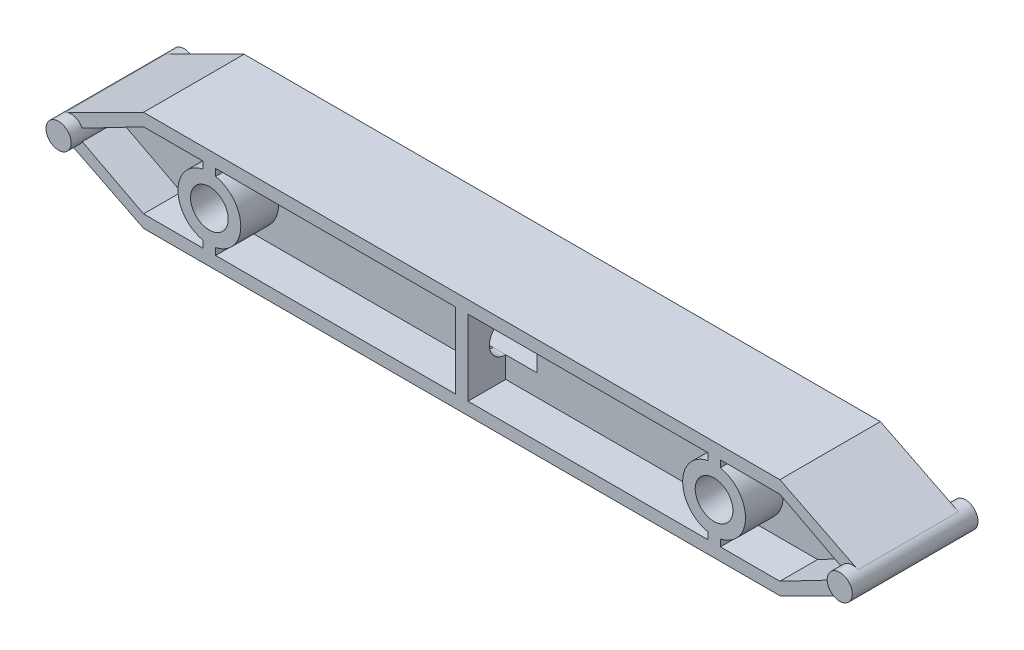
SolidWorks part; units mm, degrees
ref_plane "Front Plane" through (0, 0, 0) normal (0, 0, 1) x (1, 0, 0)
ref_plane "Top Plane" through (0, 0, 0) normal (0, 1, 0) x (1, 0, 0)
ref_plane "Right Plane" through (0, 0, 0) normal (1, 0, 0) x (0, 0, -1)
sketch "Sketch1" plane through (0, 0, 0) normal (0, 0, 1) x (1, 0, 0)
  line L0 (-74.6332, 0) -> (9.9828, 0)
  line L1 (-64.4732, -5.08) -> (-64.4732, 5.08)
  line L2 (-74.6332, 0) -> (-64.4732, 5.08)
  line L3 (-74.6332, 0) -> (-64.4732, -5.08)
  line L4 (-0.1772, -5.08) -> (-0.1772, 5.08)
  line L5 (-0.1772, 5.08) -> (9.9828, 0)
  line L6 (-0.1772, -5.08) -> (9.9828, 0)
  line L7 (-64.4732, 5.08) -> (-0.1772, 5.08)
  line L8 (-64.4732, -5.08) -> (-0.1772, -5.08)
  point P6 (-64.4732, 0)
  point P9 (-0.1772, 0)
  dimension "D1" = 84.6159
  dimension "D2" = 90
  dimension "D3" = 10.16
  dimension "D4" = 10.16
  dimension "D5" = 90
  dimension "D6" = 10.16
  dimension "D7" = 10.16
extrude "Boss-Extrude3" add sketch "Sketch1" along normal blind 10.16 contours L2 L0 L1 | L0 L3 L1 | L7 L1 L0 L4 | L1 L8 L4 L0 | L4 L6 L0 | L5 L4 L0
sketch "Sketch4" plane through (0, 0, 10.16) normal (0, 0, 1) x (1, 0, 0)
  line L0 (-74.6332, 0) -> (-64.4732, -5.08) construction
  line L1 (-74.6332, 0) -> (-64.4732, 5.08) construction
  line L2 (-0.1772, -5.08) -> (9.9828, 0) construction
  line L3 (-0.1772, 5.08) -> (9.9828, 0) construction
  line L4 (-0.1772, 5.08) -> (-0.1772, 3.81)
  line L5 (-0.1772, -5.08) -> (-0.1772, -3.81)
  line L6 (-0.1772, 3.81) -> (6.0164, 0.5863)
  line L7 (-0.1772, -3.81) -> (6.0164, -0.5863)
  line L8 (-64.4732, 5.08) -> (-64.4732, 3.81)
  line L9 (-64.4732, -5.08) -> (-64.4732, -3.81)
  line L10 (-64.4732, 3.81) -> (-70.6668, 0.5863)
  line L11 (-64.4732, -3.81) -> (-70.6668, -0.5863)
  line L12 (-64.4732, -3.81) -> (-0.1772, -3.81)
  line L13 (-0.1772, 3.81) -> (-64.4732, 3.81)
  circle A0 centre (-71.7934, 0) radius 1.27
  circle A1 centre (7.1429, 0) radius 1.27
  dimension "D1" = 2.54
  dimension "D2" = 2.54
  dimension "D3" = 1.27
  dimension "D4" = 1.27
  dimension "D5" = 1.27
  dimension "D6" = 1.27
extrude "Cut-Extrude1" cut sketch "Sketch4" against normal blind 3.81 contours A1 L6 L13 L10 A0 L11 L12 L7
sketch "Sketch6" plane through (0, 0, 10.16) normal (0, 0, 1) x (1, 0, 0)
  line L0 (-0.1772, -5.08) -> (9.9828, 0) construction
  line L1 (-0.1772, 5.08) -> (9.9828, 0) construction
  line L2 (-74.6332, 0) -> (-64.4732, -5.08) construction
  line L3 (-74.6332, 0) -> (-64.4732, 5.08) construction
  circle A0 centre (-71.7934, 0) radius 1.27
  circle A1 centre (7.1429, 0) radius 1.27
  dimension "D1" = 2.54
  dimension "D2" = 2.54
extrude "Boss-Extrude4" add sketch "Sketch6" along normal blind 1.27
sketch "Sketch7" plane through (0, 0, 10.16) normal (0, 0, 1) x (1, 0, 0)
  line L0 (9.9828, 0) -> (7.7109, 1.1359) construction
  line L1 (7.7109, -1.1359) -> (9.9828, 0) construction
  line L2 (-72.3613, 1.1359) -> (-74.6332, 0) construction
  line L3 (-74.6332, 0) -> (-72.3613, -1.1359) construction
  line L4 (9.9828, 0) -> (7.7109, 1.1359)
  line L5 (7.7109, -1.1359) -> (9.9828, 0)
  line L6 (-72.3613, 1.1359) -> (-74.6332, 0)
  line L7 (-74.6332, 0) -> (-72.3613, -1.1359)
  arc A0 (7.7109, -1.1359) -> (7.7109, 1.1359) centre (7.1429, 0) ccw construction
  arc A1 (-72.3613, 1.1359) -> (-72.3613, -1.1359) centre (-71.7934, 0) ccw construction
  arc A2 (7.7109, -1.1359) -> (7.7109, 1.1359) centre (7.1429, 0) ccw
  arc A3 (-72.3613, 1.1359) -> (-72.3613, -1.1359) centre (-71.7934, 0) ccw
extrude "Cut-Extrude2" cut sketch "Sketch7" against normal through all
sketch "Sketch9" plane through (0, 0, 0) normal (0, 0, -1) x (-1, 0, 0)
  circle A0 centre (-7.1429, 0) radius 1.27
  circle A1 centre (71.7934, 0) radius 1.27
  arc A2 (72.3613, -1.1359) -> (72.3613, 1.1359) centre (71.7934, 0) ccw construction
  arc A3 (-7.7109, 1.1359) -> (-7.7109, -1.1359) centre (-7.1429, 0) ccw construction
  dimension "D1" = 2.54
  dimension "D2" = 2.54
extrude "Boss-Extrude5" add sketch "Sketch9" along normal blind 1.27
sketch "Sketch10" plane through (0, 0, 0) normal (0, 0, -1) x (-1, 0, 0)
  line L0 (0.1772, 5.08) -> (0.1772, 3.81)
  line L1 (0.1772, -5.08) -> (0.1772, -3.81)
  line L2 (0.1772, 3.81) -> (-8.4129, 0)
  line L3 (0.1772, -3.81) -> (-8.4129, 0)
  line L4 (64.4732, 5.08) -> (64.4732, 3.81)
  line L5 (64.4732, -5.08) -> (64.4732, -3.81)
  line L6 (64.4732, -3.81) -> (70.6668, -0.5863)
  line L7 (64.4732, 3.81) -> (70.6668, 0.5863)
  line L8 (64.4732, -3.81) -> (0.1772, -3.81)
  line L9 (0.1772, 3.81) -> (64.4732, 3.81)
  arc A0 (-7.7109, -1.1359) -> (-7.7109, 1.1359) centre (-7.1429, 0) ccw construction
  arc A1 (72.3613, 1.1359) -> (72.3613, -1.1359) centre (71.7934, 0) ccw construction
  circle A2 centre (71.7934, 0) radius 1.27 construction
  dimension "D1" = 1.27
  dimension "D2" = 1.27
  dimension "D3" = 1.27
  dimension "D4" = 1.27
extrude "Cut-Extrude3" cut sketch "Sketch10" against normal blind 3.81 contours L9 L2 L3 L8 L6 L7 M9 M5
sketch "Sketch11" plane through (0, 0, 6.35) normal (0, 0, 1) x (1, 0, 0)
  line L0 (-73.0634, 0) -> (-57.8234, 0)
  line L1 (-57.8234, 0) -> (-40.0434, 0)
  line L2 (8.4129, 0) -> (-6.8271, 0)
  line L3 (-6.8271, 0) -> (-24.6071, 0)
  line L4 (-38.0114, 0) -> (-26.6391, 0)
  line L5 (-36.1352, 1.651) -> (-36.1352, -1.651)
  line L6 (-36.1352, 1.651) -> (-28.5152, 1.651)
  line L7 (-36.1352, -1.651) -> (-28.5152, -1.651)
  line L8 (-28.5152, 1.651) -> (-28.5152, -1.651)
  line L9 (-36.1352, 1.651) -> (-28.5152, -1.651) construction
  line L10 (-36.1352, -1.651) -> (-28.5152, 1.651) construction
  circle A0 centre (-71.7934, 0) radius 1.27 construction
  circle A1 centre (-57.8234, 0) radius 1.905
  circle A2 centre (-40.0434, 0) radius 2.032
  circle A3 centre (7.1429, 0) radius 1.27 construction
  circle A4 centre (-6.8271, 0) radius 1.905
  circle A5 centre (-24.6071, 0) radius 2.032
  point P19 (-32.3252, 0)
  point P21 (-32.3252, 0)
  dimension "D2" = 3.81
  dimension "D4" = 4.064
  dimension "D7" = 3.81
  dimension "D8" = 4.064
  dimension "D1" = 15.24
  dimension "D3" = 17.78
  dimension "D5" = 15.24
  dimension "D6" = 17.78
  dimension "D9" = 7.62
  dimension "D10" = 3.302
extrude "Cut-Extrude5" cut sketch "Sketch11" against normal through all contours L0 A1 L1 | L1 A1 L0 | L8 L6 L5 L4 | L8 L4 L5 L7 | L2 A4 L3
sketch "Sketch12" plane through (0, 0, 6.35) normal (0, 0, 1) x (1, 0, 0)
  line L0 (-58.4584, 3.81) -> (-58.4584, -3.81)
  line L1 (-58.4584, 3.81) -> (-57.1884, 3.81)
  line L2 (-58.4584, -3.81) -> (-57.1884, -3.81)
  line L3 (-57.1884, 3.81) -> (-57.1884, -3.81)
  line L4 (-58.4584, 3.81) -> (-57.1884, -3.81) construction
  line L5 (-58.4584, -3.81) -> (-57.1884, 3.81) construction
  line L6 (-71.7934, 0) -> (7.1429, 0) construction
  line L9 (-32.9602, 3.81) -> (-32.9602, -3.81)
  line L10 (-32.9602, 3.81) -> (-31.6902, 3.81)
  line L11 (-32.9602, -3.81) -> (-31.6902, -3.81)
  line L12 (-31.6902, 3.81) -> (-31.6902, -3.81)
  line L13 (-32.9602, 3.81) -> (-31.6902, -3.81) construction
  line L14 (-32.9602, -3.81) -> (-31.6902, 3.81) construction
  line L15 (-7.4621, 3.81) -> (-7.4621, -3.81)
  line L16 (-7.4621, 3.81) -> (-6.1921, 3.81)
  line L17 (-7.4621, -3.81) -> (-6.1921, -3.81)
  line L18 (-6.1921, 3.81) -> (-6.1921, -3.81)
  line L19 (-7.4621, 3.81) -> (-6.1921, -3.81) construction
  line L20 (-7.4621, -3.81) -> (-6.1921, 3.81) construction
  circle A0 centre (-57.8234, 0) radius 3.175
  circle A1 centre (-57.8234, 0) radius 1.905 construction
  circle A2 centre (-6.8271, 0) radius 3.175
  circle A3 centre (-6.8271, 0) radius 1.905 construction
  point P12 (-32.3252, 0)
  point P16 (-32.3252, 0)
  dimension "D1" = 1.27
  dimension "D4" = 1.27
  dimension "D2" = 1.27
  dimension "D3" = 1.27
  dimension "D5" = 1.27
extrude "Boss-Extrude6" add sketch "Sketch12" along normal blind 3.81
sketch "Sketch13" plane through (-32.9602, 0, 0) normal (-1, 0, 0) x (0, 0, 1)
  line L0 (6.35, 1.651) -> (6.35, -1.651) construction
  circle A0 centre (6.35, 0) radius 1.651
extrude "Cut-Extrude6" cut sketch "Sketch13" against normal blind 3.81
sketch "Sketch14" plane through (0, 0, 3.81) normal (0, 0, -1) x (-1, 0, 0)
  line L0 (6.1921, 3.81) -> (6.1921, -3.81)
  line L1 (6.1921, 3.81) -> (7.4621, 3.81)
  line L2 (6.1921, -3.81) -> (7.4621, -3.81)
  line L3 (7.4621, 3.81) -> (7.4621, -3.81)
  line L4 (6.1921, 3.81) -> (7.4621, -3.81) construction
  line L5 (6.1921, -3.81) -> (7.4621, 3.81) construction
  line L6 (57.1884, 3.81) -> (57.1884, -3.81)
  line L7 (57.1884, 3.81) -> (58.4584, 3.81)
  line L8 (57.1884, -3.81) -> (58.4584, -3.81)
  line L9 (58.4584, 3.81) -> (58.4584, -3.81)
  line L10 (57.1884, 3.81) -> (58.4584, -3.81) construction
  line L11 (57.1884, -3.81) -> (58.4584, 3.81) construction
  circle A0 centre (6.8271, 0) radius 3.175
  circle A1 centre (6.8271, 0) radius 1.905 construction
  circle A2 centre (57.8234, 0) radius 3.175
  circle A3 centre (57.8234, 0) radius 1.905 construction
  dimension "D1" = 1.27
  dimension "D3" = 1.27
  dimension "D2" = 1.27
  dimension "D4" = 1.27
extrude "Boss-Extrude7" add sketch "Sketch14" along normal blind 3.81 contours A2 L9 L6 M7 | L9 A2 L6 M6 | L6 A2 M6 | L9 A2 M6 | L6 A2 L9 M6 | A2 L6 L9 M11 | A0 L3 L0 M7 | L3 A0 L0 M3 | L0 A0 M3 | L0 A0 L3 M3 | A0 L0 L3 M11 | L3 A0 M3
